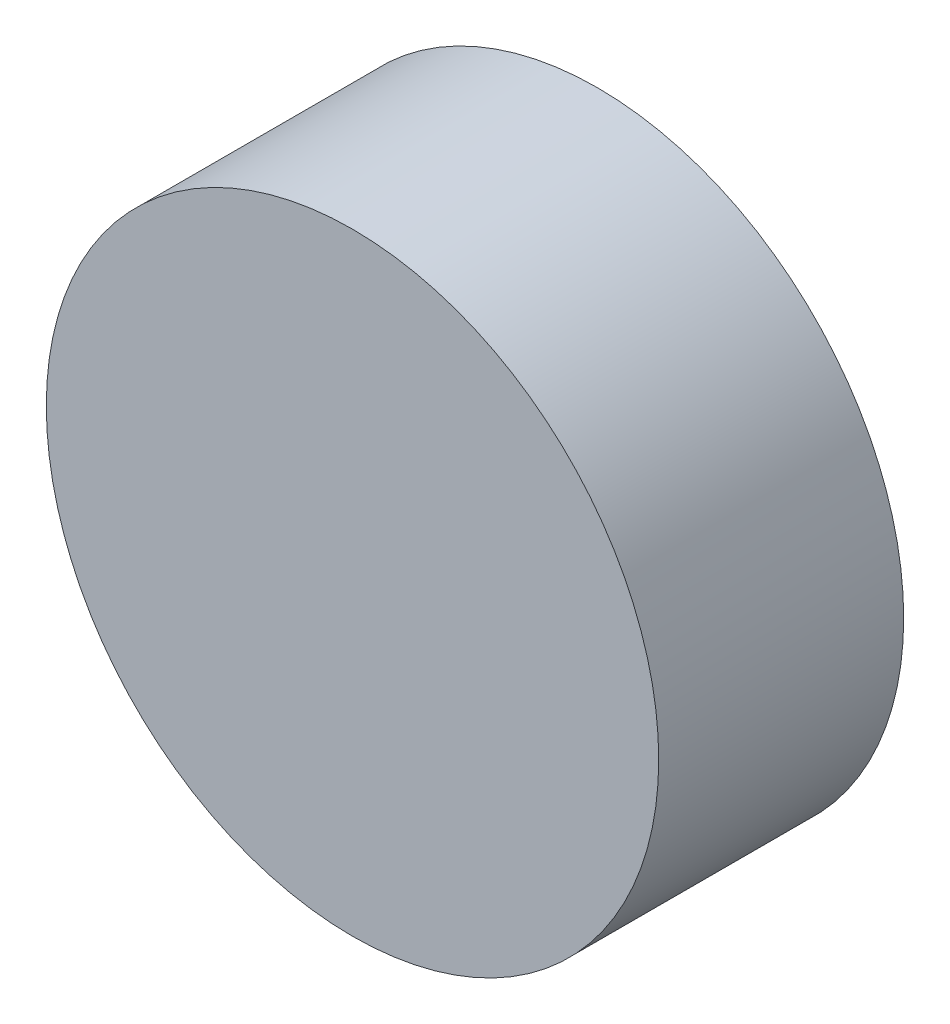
SolidWorks part; units mm, degrees
ref_plane "Ebene vorne" through (0, 0, 0) normal (0, 0, 1) x (1, 0, 0)
ref_plane "Ebene oben" through (0, 0, 0) normal (0, 1, 0) x (1, 0, 0)
ref_plane "Ebene rechts" through (0, 0, 0) normal (1, 0, 0) x (0, 0, -1)
sketch "Skizze1" plane through (0, 0, 0) normal (0, 0, 1) x (1, 0, 0)
  circle A0 centre (0, 0) radius 12.5
  dimension "D1" = 25
extrude "Aufsatz-Linear austragen1" add sketch "Skizze1" along normal blind 10
